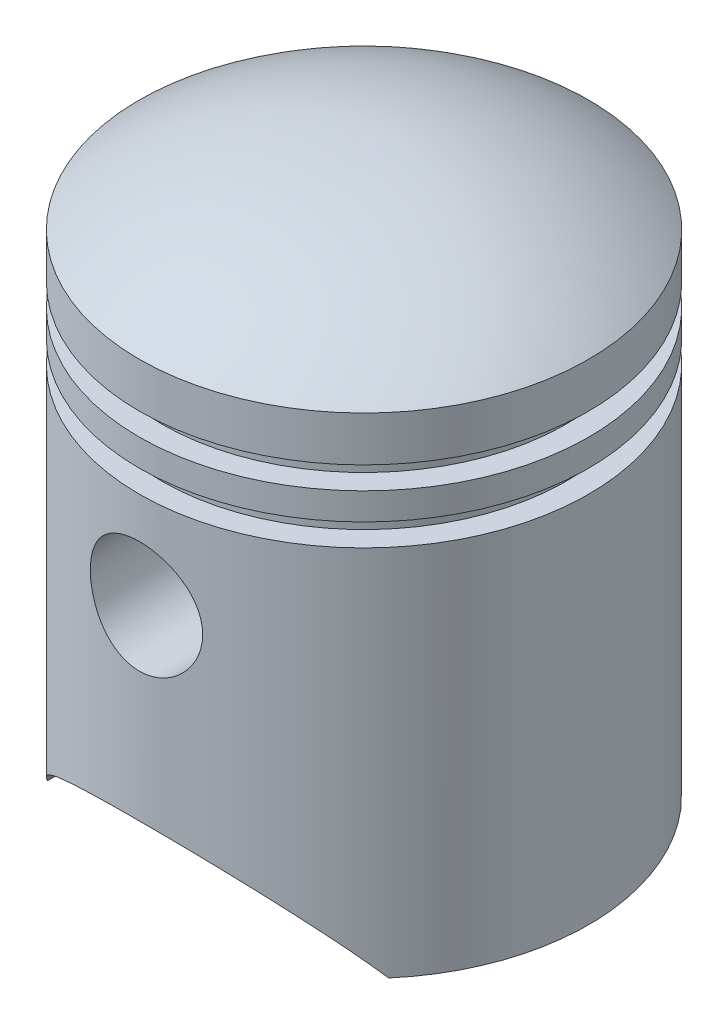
SolidWorks part; units mm, degrees
ref_plane "Front Plane" through (0, 0, 0) normal (0, 0, 1) x (1, 0, 0)
ref_plane "Top Plane" through (0, 0, 0) normal (0, 1, 0) x (1, 0, 0)
ref_plane "Right Plane" through (0, 0, 0) normal (1, 0, 0) x (0, 0, -1)
sketch "Sketch1" plane through (0, 0, 0) normal (0, 0, 1) x (1, 0, 0)
  line L0 (0, 62.5) -> (0, 60.4994)
  line L1 (23, 0) -> (25, 0)
  line L2 (25, 0) -> (25, 41.5)
  line L3 (25, 41.5) -> (22.5, 41.5)
  line L4 (22.5, 41.5) -> (22.5, 44)
  line L5 (22.5, 44) -> (25, 44)
  line L6 (25, 44) -> (25, 47)
  line L7 (25, 47) -> (22.5, 47)
  line L8 (22.5, 47) -> (22.5, 49.5)
  line L9 (22.5, 49.5) -> (25, 49.5)
  line L10 (25, 49.5) -> (25, 54.5)
  line L11 (0, 62.5) -> (0, 0) construction
  line L12 (0, 0) -> (25, 0) construction
  line L13 (23, 0) -> (23, 39.5)
  line L14 (23, 39.5) -> (20.5, 39.5)
  line L15 (20.5, 39.5) -> (20.5, 45.5)
  line L16 (20.5, 45.5) -> (20.5, 45.5)
  line L17 (20.5, 45.5) -> (20.5, 45.5)
  line L18 (20.5, 45.5) -> (20.5, 45.5)
  line L19 (20.5, 45.5) -> (20.5, 51.5)
  line L20 (20.5, 51.5) -> (23, 51.5)
  line L21 (23, 51.5) -> (23, 53.4845)
  line L22 (23, 2) -> (23, 39.5) construction
  line L23 (2, 2) -> (23, 2) construction
  line L24 (2, 60.4985) -> (2, 2) construction
  arc A0 (25, 54.5) -> (0, 62.5) centre (0.9839, 22.5121) ccw
  arc A1 (23, 53.4845) -> (0, 60.4994) centre (0.9839, 22.5121) ccw
  arc A2 (23, 53.4845) -> (2, 60.4985) centre (0.9839, 22.5121) ccw construction
  dimension "D8" = 40
  dimension "D3" = 41.5
  dimension "D4" = 5
  dimension "D5" = 2.5
  dimension "D6" = 2.5
  dimension "D7" = 3
  dimension "D9" = 2
revolve "Revolve1" add sketch "Sketch1" angle 360 about L0
sketch "Sketch2" plane through (0, 0, 0) normal (0, 0, 1) x (1, 0, 0)
  line L0 (19, 0) -> (-19, 0)
  line L1 (-25, 0) -> (25, 0) construction
  line L2 (-19, 0) -> (19, 0)
  line L3 (0, 0) -> (0, 10) construction
  arc A0 (-19, 0) -> (19, 0) centre (0, -13.0322) cw
  dimension "D1" = 10
  dimension "D2" = 38
extrude "Cut-Extrude1" cut sketch "Sketch2" against normal mid plane 70
sketch "Sketch3" plane through (0, 0, 0) normal (0, 0, 1) x (1, 0, 0)
  line L0 (0, 62.696) -> (0, 30.696) construction
  circle A0 centre (0, 30.696) radius 6.25
  dimension "D2" = 12.5
  dimension "D1" = 32
extrude "Cut-Extrude2" cut sketch "Sketch3" against normal mid plane 80
ref_plane "Plane1" through (0, 0, 12) normal (0, 0, 1) x (1, 0, 0)
sketch "Sketch5" plane through (0, 0, 12) normal (0, 0, 1) x (1, 0, 0)
  circle A0 centre (0, 30.696) radius 6.25 construction
  circle A1 centre (0, 30.696) radius 6.25
  circle A2 centre (0, 30.696) radius 7.25
  dimension "D1" = 14.5
extrude "Boss-Extrude1" add sketch "Sketch5" along normal up to next
mirror "Mirror1" about plane through (0, 0, 0) normal (0, 0, 1) of "Boss-Extrude1"
